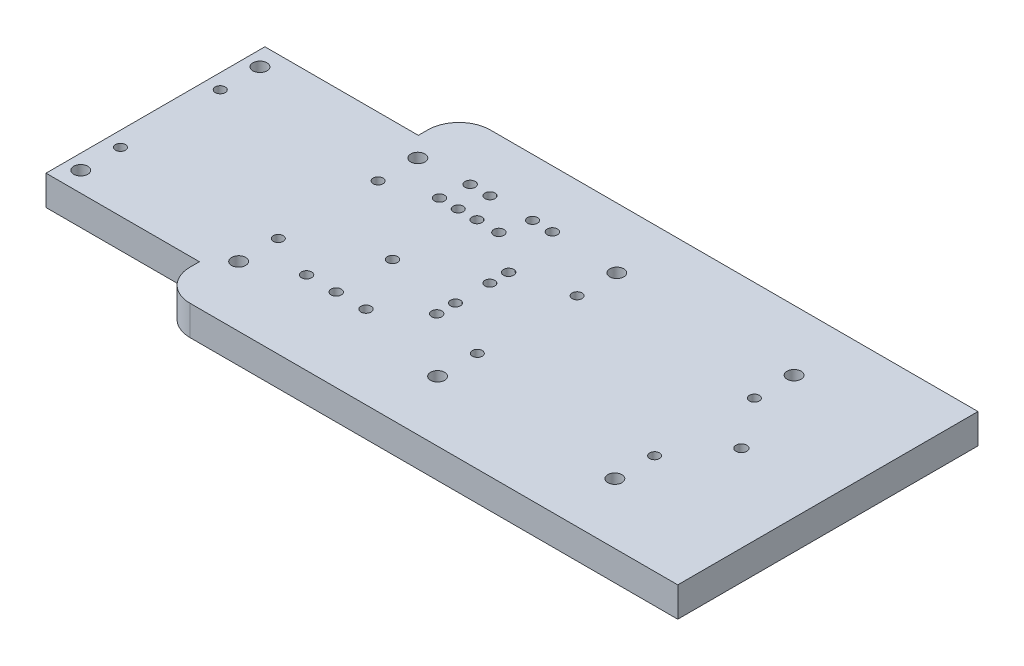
SolidWorks part; units mm, degrees
ref_plane "Front Plane" through (0, 0, 0) normal (0, 0, 1) x (1, 0, 0)
ref_plane "Top Plane" through (0, 0, 0) normal (0, 1, 0) x (1, 0, 0)
ref_plane "Right Plane" through (0, 0, 0) normal (1, 0, 0) x (0, 0, -1)
sketch "Sketch1" plane through (0, 0, 0) normal (0, 1, 0) x (1, 0, 0)
  line L0 (-88, 50) -> (133.25, -50) construction
  line L1 (133.25, -50) -> (-88, -50)
  line L2 (133.25, -50) -> (133.25, 50)
  line L3 (133.25, 50) -> (-88, 50)
  line L4 (-88, -50) -> (-88, 50)
  line L5 (133.25, 50) -> (-88, -50) construction
  point P0 (0, 0)
  point P5 (22.625, 0)
  dimension "D1" = 100
  dimension "D2" = 221.25
  dimension "D3" = 22.625
extrude "Boss-Extrude1" add sketch "Sketch1" along normal blind 9.525
sketch "Sketch4" plane through (0, 9.525, 0) normal (0, 1, 0) x (1, 0, 0)
  line L1 (-88, 50) -> (-35, 50)
  line L2 (-88, 50) -> (-88, 35)
  line L3 (-88, 35) -> (-35, 35)
  line L4 (-35, 50) -> (-35, 35)
  line L5 (-88, -50) -> (-35, -50)
  line L6 (-88, -50) -> (-88, -35)
  line L7 (-88, -35) -> (-35, -35)
  line L8 (-35, -50) -> (-35, -35)
  dimension "D1" = 15
  dimension "D2" = 53
extrude "Cut-Extrude3" cut sketch "Sketch4" against normal up to next
sketch "Sketch5" plane through (-88, 0, 0) normal (-1, 0, 0) x (0, 0, 1)
  line L1 (-35, 0) -> (35, 0)
  line L2 (-35, 0) -> (-35, 9.525)
  line L3 (-35, 9.525) -> (35, 9.525)
  line L4 (35, 0) -> (35, 9.525)
extrude "Cut-Extrude4" cut sketch "Sketch5" against normal blind 3.95
sketch "Sketch6" plane through (0, 9.525, 0) normal (0, 1, 0) x (1, 0, 0)
  line L0 (133.25, -50) -> (133.25, 50) construction
  line L1 (-35, 50) -> (133.25, 50)
  line L2 (-35, 50) -> (-35, 48)
  line L3 (-35, 48) -> (133.25, 48)
  line L4 (133.25, 50) -> (133.25, 48)
  line L5 (0, 0) -> (-50000, 0) construction
  line L6 (133.25, -50) -> (133.25, -48)
  line L7 (-35, -48) -> (133.25, -48)
  line L8 (-35, -50) -> (-35, -48)
  line L9 (-35, -50) -> (133.25, -50)
  dimension "D1" = 2
extrude "Cut-Extrude5" cut sketch "Sketch6" against normal up to next
sketch "Sketch7" plane through (0, 9.525, 0) normal (0, 1, 0) x (1, 0, 0)
  line L0 (-35, -35) -> (-84.05, -35) construction
  line L1 (-84.05, -35) -> (-84.05, 35) construction
  line L2 (-84.05, 35) -> (-35, 35) construction
  circle A0 centre (-79.55, -17.5) radius 2
  circle A1 centre (-79.55, 17.5) radius 2
  point P8 (-59.525, 35)
  dimension "D1" = 4
  dimension "D2" = 4
  dimension "D3" = 17.5
  dimension "D4" = 4.5
  dimension "D5" = 4.5
  dimension "D6" = 17.5
sketch "SHWS" plane through (0, 9.525, 0) normal (0, 1, 0) x (1, 0, 0)
  line L0 (-84.05, -35) -> (-84.05, 35) construction
  line L1 (-35, 48) -> (133.25, 48) construction
  line L2 (133.25, -48) -> (-35, -48) construction
  circle A0 centre (-18, -38.04) radius 1.5
  circle A1 centre (3, -38.04) radius 1.5
  circle A2 centre (-18, 38.04) radius 1.5
  circle A3 centre (3, 38.04) radius 1.5
  dimension "D1" = 3
  dimension "D2" = 3
  dimension "D3" = 3
  dimension "D4" = 3
  dimension "D5" = 66.05
  dimension "D6" = 66.05
  dimension "D7" = 9.96
  dimension "D8" = 9.96
  dimension "D9" = 9.96
  dimension "D10" = 87.05
  dimension "D11" = 9.96
  dimension "D12" = 87.05
sketch "Proto Image Detector" plane through (0, 9.525, 0) normal (0, 1, 0) x (1, 0, 0)
  line L0 (-84.05, -35) -> (-84.05, 35) construction
  line L1 (133.25, -48) -> (-35, -48) construction
  circle A3 centre (103.3, 0) radius 1.5
  dimension "D3" = 3
  dimension "D7" = 48
  dimension "D8" = 187.35
sketch "Optical Posts" plane through (0, 0, 0) normal (0, -1, 0) x (-1, 0, 0)
  line L0 (84.05, -35) -> (84.05, 35) construction
  line L1 (-133.25, -48) -> (-133.25, 48) construction
  circle A0 centre (54.05, 0) radius 1.5
  circle A1 centre (-73.25, 0) radius 1.5
  point P4 (84.05, 0)
  dimension "D3" = 3
  dimension "D1" = 30
  dimension "D2" = 60
hole_wizard "Tap Drill for #8-32 Tap1" positions "Sketch39" profile "Sketch38" hole size "#8-32" standard "ANSI Inch"
sketch "Sketch39" plane through (0, 0, 0) normal (0, -1, 0) x (-1, 0, 0)
  point P0 (54.05, 0)
  point P3 (-73.25, 0)
sketch "Sketch38" plane through (-54.05, 0, 0) normal (1, 0, 0) x (0, 0, -1)
  line L0 (0, 0) -> (0, 7.3878)
  line L1 (0, 7.3878) -> (1.7272, 6.35)
  line L2 (1.7272, 6.35) -> (1.7272, 0)
  line L5 (1.7272, 0) -> (0, 0)
  line L10 (0, 7.3878) -> (-1.7272, 6.35) construction
  line L11 (0, -6.35) -> (0, 107.95) construction
  dimension "Hole Dia." = 3.4544
  dimension "Hole Depth" = 6.35
  dimension "Drill Angle" = 118
sketch "Lens Mount Dowels" plane through (0, 9.525, 0) normal (0, 1, 0) x (1, 0, 0)
  line L0 (-84.05, 35) -> (-35, 35) construction
  line L1 (-35, -35) -> (-84.05, -35) construction
  line L2 (-84.05, -35) -> (-84.05, 35) construction
  circle A0 centre (-79.2875, 15.95) radius 1.5
  circle A1 centre (-79.2875, -15.95) radius 1.5
  circle A2 centre (-28.8075, 15.95) radius 1.5
  circle A3 centre (-28.8075, -15.95) radius 1.5
  circle A4 centre (34.81, 15.95) radius 1.5
  circle A5 centre (34.81, -15.95) radius 1.5
  circle A6 centre (91.49, 15.95) radius 1.5
  circle A7 centre (91.49, -15.95) radius 1.5
  dimension "D1" = 3
  dimension "D2" = 19.05
  dimension "D3" = 19.05
  dimension "D4" = 4.7625
  dimension "D5" = 4.7625
  dimension "D6" = 50.48
  dimension "D8" = 19.05
  dimension "D9" = 19.05
  dimension "D10" = 56.68
  dimension "D12" = 118.86
  dimension "D13" = 118.86
sketch "Lens Mounts" plane through (0, 0, 0) normal (0, -1, 0) x (1, 0, 0)
  line L0 (-35, -35) -> (-84.05, -35) construction
  line L1 (-79.2875, 28.65) -> (-28.8075, 28.65)
  line L2 (-79.2875, 28.65) -> (-79.2875, -28.65)
  line L3 (-79.2875, -28.65) -> (-28.8075, -28.65)
  line L4 (-28.8075, 28.65) -> (-28.8075, -28.65)
  line L5 (34.81, 28.65) -> (91.49, 28.65)
  line L6 (34.81, 28.65) -> (34.81, -28.65)
  line L7 (34.81, -28.65) -> (91.49, -28.65)
  line L8 (91.49, 28.65) -> (91.49, -28.65)
  line L9 (-84.05, -35) -> (-84.05, 35) construction
  dimension "D1" = 50.48
  dimension "D2" = 57.3
  dimension "D3" = 6.35
  dimension "D4" = 4.7625
  dimension "D5" = 56.68
  dimension "D6" = 57.3
  dimension "D7" = 6.35
  dimension "D8" = 118.86
hole_wizard "CBORE for #8 Socket Head Cap Screw1" positions "Sketch52" profile "Sketch51" counterbore size "#8" standard "ANSI Inch"
sketch "Sketch52" plane through (0, 0, 0) normal (0, -1, 0) x (-1, 0, 0)
  point P0 (79.2875, -28.65)
  point P3 (79.2875, 28.65)
  point P6 (28.8075, -28.65)
  point P9 (28.8075, 28.65)
  point P12 (-34.81, -28.65)
  point P15 (-91.49, -28.65)
  point P18 (-91.49, 28.65)
  point P21 (-34.81, 28.65)
sketch "Sketch51" plane through (-79.2875, 0, 28.65) normal (1, 0, 0) x (0, 0, -1)
  line L0 (0, 0) -> (0, 9.525)
  line L1 (0, 9.525) -> (2.2479, 9.525)
  line L3 (2.2479, 9.525) -> (2.2479, 4.1656)
  line L4 (2.2479, 4.1656) -> (3.9687, 4.1656)
  line L5 (3.9687, 4.1656) -> (3.9688, 0)
  line L7 (3.9688, 0) -> (0, 0)
  line L11 (0, -6.35) -> (0, 107.95) construction
  dimension "Thru Hole Dia." = 4.4958
  dimension "Thru Hole Depth" = 9.525
  dimension "C'Bore Dia." = 7.9375
  dimension "C'Bore Depth" = 4.1656
hole_wizard "1/8 (0.125) Press Dowel Hole1" positions "Sketch54" profile "Sketch53" hole size "1/8" standard "ANSI Inch"
sketch "Sketch54" plane through (0, 9.525, 0) normal (0, 1, 0) x (1, 0, 0)
  point P0 (-79.2875, -15.95)
  point P3 (-79.2875, 15.95)
  point P6 (-28.8075, 15.95)
  point P9 (-28.8075, -15.95)
  point P12 (34.81, 15.95)
  point P15 (34.81, -15.95)
  point P18 (91.49, -15.95)
  point P21 (91.49, 15.95)
sketch "Sketch53" plane through (-79.2875, 9.525, 15.95) normal (1, 0, 0) x (0, 0, 1)
  line L0 (0, 0) -> (0, 9.525)
  line L1 (0, 9.525) -> (1.5875, 9.525)
  line L2 (1.5875, 9.525) -> (1.5875, 0)
  line L5 (1.5875, 0) -> (0, 0)
  line L11 (0, -6.35) -> (0, 107.95) construction
  dimension "Thru Hole Dia." = 3.175
  dimension "Thru Hole Depth" = 9.525
hole_wizard "Tap Drill for #8-32 Tap2" positions "Sketch56" profile "Sketch55" hole size "#8-32" standard "ANSI Inch"
sketch "Sketch56" plane through (0, 9.525, 0) normal (0, 1, 0) x (1, 0, 0)
  point P0 (103.3, 0)
sketch "Sketch55" plane through (103.3, 9.525, 0) normal (1, 0, 0) x (0, 0, 1)
  line L0 (0, 0) -> (0, 7.3878)
  line L1 (0, 7.3878) -> (1.7272, 6.35)
  line L2 (1.7272, 6.35) -> (1.7272, 0)
  line L5 (1.7272, 0) -> (0, 0)
  line L10 (0, 7.3878) -> (-1.7272, 6.35) construction
  line L11 (0, -6.35) -> (0, 107.95) construction
  dimension "Hole Dia." = 3.4544
  dimension "Hole Depth" = 6.35
  dimension "Drill Angle" = 118
sketch "Mask Mech" plane through (0, 0, 0) normal (0, -1, 0) x (1, 0, 0)
  line L0 (17.37, -11.5) -> (17.37, -5.5)
  line L1 (-35, 48) -> (133.25, 48) construction
  line L2 (17.37, 5.5) -> (17.37, 11.5)
  line L3 (133.25, -48) -> (-35, -48) construction
  line L4 (-84.05, -35) -> (-84.05, 35) construction
  dimension "D1" = 6
  dimension "D2" = 6
  dimension "D3" = 36.5
  dimension "D4" = 36.5
  dimension "D5" = 101.42
  dimension "D6" = 101.42
hole_wizard "CBORE for #4 Socket Head Cap Screw1" positions "Sketch59" profile "Sketch58" counterbore size "#4" standard "ANSI Inch"
sketch "Sketch59" plane through (0, 0, 0) normal (0, -1, 0) x (-1, 0, 0)
  point P0 (-17.37, 11.5)
  point P3 (-17.37, -11.5)
sketch "Sketch58" plane through (17.37, 0, -11.5) normal (1, 0, 0) x (0, 0, -1)
  line L0 (0, 0) -> (0, 9.525)
  line L1 (0, 9.525) -> (1.6319, 9.525)
  line L3 (1.6319, 9.525) -> (1.6319, 2.8448)
  line L4 (1.6319, 2.8448) -> (2.7788, 2.8448)
  line L5 (2.7788, 2.8448) -> (2.7788, 0)
  line L7 (2.7788, 0) -> (0, 0)
  line L11 (0, -6.35) -> (0, 107.95) construction
  dimension "Thru Hole Dia." = 3.2639
  dimension "Thru Hole Depth" = 9.525
  dimension "C'Bore Dia." = 5.5575
  dimension "C'Bore Depth" = 2.8448
hole_wizard "1/8 (0.125) Press Dowel Hole2" positions "Sketch61" profile "Sketch60" hole size "1/8" standard "ANSI Inch"
sketch "Sketch61" plane through (0, 0, 0) normal (0, -1, 0) x (-1, 0, 0)
  point P0 (-17.37, 5.5)
  point P3 (-17.37, -5.5)
sketch "Sketch60" plane through (17.37, 0, -5.5) normal (1, 0, 0) x (0, 0, -1)
  line L0 (0, 0) -> (0, 9.525)
  line L1 (0, 9.525) -> (1.5875, 9.525)
  line L2 (1.5875, 9.525) -> (1.5875, 0)
  line L5 (1.5875, 0) -> (0, 0)
  line L11 (0, -6.35) -> (0, 107.95) construction
  dimension "Thru Hole Dia." = 3.175
  dimension "Thru Hole Depth" = 9.525
sketch "Beam Splitter" plane through (0, 0, 0) normal (0, -1, 0) x (1, 0, 0)
  line L0 (-84.05, -35) -> (-84.05, 35) construction
  line L1 (4.76, 21.5) -> (-14.24, 21.5)
  line L2 (4.76, 21.5) -> (4.76, -21)
  line L3 (4.76, -21) -> (-14.24, -21)
  line L4 (-14.24, 21.5) -> (-14.24, -21)
  line L5 (-35, 48) -> (133.25, 48) construction
  line L7 (-8.24, -21) -> (-2.24, -21)
  line L8 (-8.24, -21) -> (-8.24, 21.5)
  line L9 (-8.24, 21.5) -> (-2.24, 21.5)
  line L10 (-2.24, -21) -> (-2.24, 21.5)
  dimension "D1" = 19
  dimension "D2" = 42.5
  dimension "D3" = 69.81
  dimension "D4" = 26.5
  dimension "D5" = 6
  dimension "D6" = 7
hole_wizard "1/8 (0.125) Press Dowel Hole3" positions "Sketch64" profile "Sketch63" hole size "1/8" standard "ANSI Inch"
sketch "Sketch64" plane through (0, 0, 0) normal (0, -1, 0) x (-1, 0, 0)
  point P0 (2.24, 21)
  point P3 (8.24, 21)
sketch "Sketch63" plane through (-2.24, 0, -21) normal (1, 0, 0) x (0, 0, -1)
  line L0 (0, 0) -> (0, 9.525)
  line L1 (0, 9.525) -> (1.5875, 9.525)
  line L2 (1.5875, 9.525) -> (1.5875, 0)
  line L5 (1.5875, 0) -> (0, 0)
  line L11 (0, -6.35) -> (0, 107.95) construction
  dimension "Thru Hole Dia." = 3.175
  dimension "Thru Hole Depth" = 9.525
hole_wizard "CBORE for #4 Socket Head Cap Screw2" positions "Sketch66" profile "Sketch65" counterbore size "#4" standard "ANSI Inch"
sketch "Sketch66" plane through (0, 0, 0) normal (0, -1, 0) x (-1, 0, 0)
  point P0 (-4.76, 21)
  point P3 (14.24, 21)
  point P6 (14.24, -21.5)
  point P9 (-4.76, -21.5)
sketch "Sketch65" plane through (4.76, 0, -21) normal (1, 0, 0) x (0, 0, -1)
  line L0 (0, 0) -> (0, 9.525)
  line L1 (0, 9.525) -> (1.6319, 9.525)
  line L3 (1.6319, 9.525) -> (1.6319, 2.8448)
  line L4 (1.6319, 2.8448) -> (2.7788, 2.8448)
  line L5 (2.7788, 2.8448) -> (2.7788, 0)
  line L7 (2.7788, 0) -> (0, 0)
  line L11 (0, -6.35) -> (0, 107.95) construction
  dimension "Thru Hole Dia." = 3.2639
  dimension "Thru Hole Depth" = 9.525
  dimension "C'Bore Dia." = 5.5575
  dimension "C'Bore Depth" = 2.8448
sketch "Motor" plane through (0, 0, 0) normal (0, -1, 0) x (1, 0, 0)
  line L0 (-4.74, 21.52) -> (-4.74, 3.52)
  line L2 (-35, 48) -> (133.25, 48) construction
  circle A1 centre (-14.24, 21.5) radius 1.632 construction
  dimension "D1" = 18
  dimension "D2" = 9.5
  dimension "D3" = 26.48
hole_wizard "CBORE for #4 Socket Head Cap Screw3" positions "Sketch69" profile "Sketch68" counterbore size "#4" standard "ANSI Inch"
sketch "Sketch69" plane through (0, 0, 0) normal (0, -1, 0) x (-1, 0, 0)
  point P0 (4.74, -21.52)
  point P3 (4.74, -3.52)
sketch "Sketch68" plane through (-4.74, 0, 21.52) normal (1, 0, 0) x (0, 0, -1)
  line L0 (0, 0) -> (0, 9.525)
  line L1 (0, 9.525) -> (1.6319, 9.525)
  line L3 (1.6319, 9.525) -> (1.6319, 2.8448)
  line L4 (1.6319, 2.8448) -> (2.7788, 2.8448)
  line L5 (2.7788, 2.8448) -> (2.7788, 0)
  line L7 (2.7788, 0) -> (0, 0)
  line L11 (0, -6.35) -> (0, 107.95) construction
  dimension "Thru Hole Dia." = 3.2639
  dimension "Thru Hole Depth" = 9.525
  dimension "C'Bore Dia." = 5.5575
  dimension "C'Bore Depth" = 2.8448
sketch "Sketch70" plane through (0, 0, 0) normal (0, -1, 0) x (-1, 0, 0)
  line L0 (-133.25, 48) -> (35, 48) construction
  line L1 (-13.16, -29.7) -> (13.14, -29.7)
  line L2 (-13.16, -29.7) -> (-13.16, 29.705)
  line L3 (-13.16, 29.705) -> (13.14, 29.705)
  line L4 (13.14, -29.7) -> (13.14, 29.705)
  line L5 (-6.81, 29.705) -> (6.79, 29.705)
  line L6 (-6.81, 29.705) -> (-6.81, -29.7)
  line L7 (-6.81, -29.7) -> (6.79, -29.7)
  line L8 (6.79, 29.705) -> (6.79, -29.7)
  line L9 (35, -48) -> (-133.25, -48) construction
  line L10 (84.05, 35) -> (84.05, -35) construction
  dimension "D1" = 26.3
  dimension "D2" = 6.35
  dimension "D3" = 13.6
  dimension "D4" = 18.295
  dimension "D5" = 18.3
  dimension "D6" = 70.91
hole_wizard "CBORE for #4 Socket Head Cap Screw4" positions "Sketch72" profile "Sketch71" counterbore size "#4" standard "ANSI Inch"
sketch "Sketch72" plane through (0, 0, 0) normal (0, -1, 0) x (-1, 0, 0)
  point P0 (13.14, 29.705)
  point P3 (-13.16, 29.705)
sketch "Sketch71" plane through (-13.14, 0, -29.705) normal (1, 0, 0) x (0, 0, -1)
  line L0 (0, 0) -> (0, 9.525)
  line L1 (0, 9.525) -> (1.6319, 9.525)
  line L3 (1.6319, 9.525) -> (1.632, 2.8448)
  line L4 (1.632, 2.8448) -> (2.7788, 2.8448)
  line L5 (2.7788, 2.8448) -> (2.7788, 0)
  line L7 (2.7788, 0) -> (0, 0)
  line L11 (0, -6.35) -> (0, 107.95) construction
  dimension "Thru Hole Dia." = 3.2639
  dimension "Thru Hole Depth" = 9.525
  dimension "C'Bore Dia." = 5.5575
  dimension "C'Bore Depth" = 2.8448
hole_wizard "1/8 (0.125) Press Dowel Hole4" positions "Sketch74" profile "Sketch73" hole size "1/8" standard "ANSI Inch"
sketch "Sketch74" plane through (0, 0, 0) normal (0, -1, 0) x (-1, 0, 0)
  point P0 (-6.81, 29.705)
  point P3 (6.79, 29.705)
sketch "Sketch73" plane through (6.81, 0, -29.705) normal (1, 0, 0) x (0, 0, -1)
  line L0 (0, 0) -> (0, 9.525)
  line L1 (0, 9.525) -> (1.5875, 9.525)
  line L2 (1.5875, 9.525) -> (1.5875, 0)
  line L5 (1.5875, 0) -> (0, 0)
  line L11 (0, -6.35) -> (0, 107.95) construction
  dimension "Thru Hole Dia." = 3.175
  dimension "Thru Hole Depth" = 9.525
fillet "Fillet1" radius 10 2 edges at (-35, 4.7625, 48) (-35, 4.7625, -48)
sketch "Sketch75" plane through (0, 9.525, 0) normal (0, 1, 0) x (1, 0, 0)
  line L0 (133.25, -48) -> (-25, -48) construction
  line L1 (133.25, 48) -> (130.95, 48)
  line L2 (133.25, 48) -> (133.25, -48)
  line L3 (133.25, -48) -> (130.95, -48)
  line L4 (130.95, 48) -> (130.95, -48)
  dimension "D1" = 2.3
extrude "Cut-Extrude6" cut sketch "Sketch75" against normal blind 10
